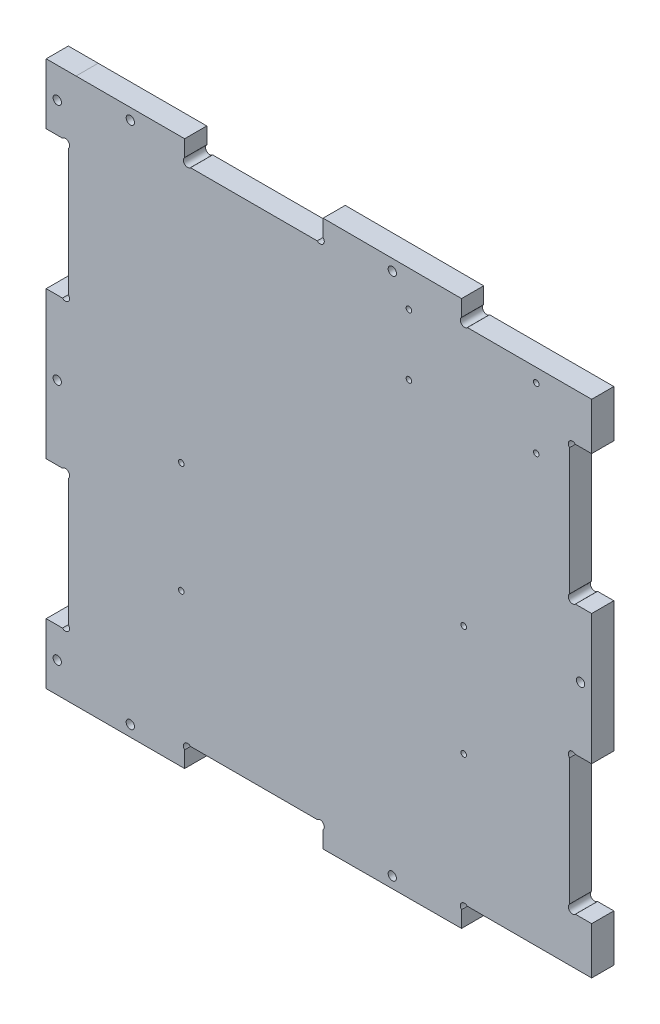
SolidWorks part; units mm, degrees
ref_plane "Plan de face" through (0, 0, 0) normal (0, 0, 1) x (1, 0, 0)
ref_plane "Plan de dessus" through (0, 0, 0) normal (0, 1, 0) x (1, 0, 0)
ref_plane "Plan de droite" through (0, 0, 0) normal (1, 0, 0) x (0, 0, -1)
sketch "Esquisse1" plane through (0, 0, 0) normal (0, 0, 1) x (1, 0, 0)
  line L0 (-32.5678, 3.0393) -> (-40.5679, 24.9325) construction
  line L1 (-40.5679, 24.9325) -> (7.3108, 24.9325) construction
  line L2 (57.3108, 16.9325) -> (11.5535, 16.9325)
  line L3 (9.4321, 24.9325) -> (9.4321, 19.0538)
  line L5 (9.4321, 16.9325) -> (13.1244, 20.6247) construction
  line L6 (156.4321, 16.9325) -> (156.4321, -0.0675)
  line L7 (-34.6892, -46.9607) -> (-40.5679, -46.9607)
  line L8 (59.4321, 25.0903) -> (109.4321, 24.9383)
  line L9 (59.4321, 25.0903) -> (59.4321, 19.0538)
  line L10 (156.4321, -0.0675) -> (150.5535, -0.0675)
  line L11 (156.4321, 16.9325) -> (111.5535, 16.9325)
  line L12 (109.4321, 19.2124) -> (109.4321, 24.9383)
  line L13 (109.4321, 16.9325) -> (113.4674, 20.9678) construction
  line L14 (59.4321, 16.9325) -> (54.8293, 21.5354) construction
  line L15 (-32.5678, 3.0393) -> (-39.0884, -3.4813) construction
  line L16 (-32.5679, -46.9607) -> (-37.4104, -42.1182) construction
  line L17 (156.4321, -73.5675) -> (-71.4834, -73.5675) construction
  line L18 (156.4321, -45.0675) -> (156.4321, -102.0675) construction
  line L19 (-40.5679, -46.9607) -> (-40.5679, -100.1743)
  line L20 (109.4321, 19.0538) -> (109.4321, 19.2124)
  line L21 (148.4321, -2.1888) -> (148.4321, -47.9462)
  line L22 (150.5535, -50.0675) -> (156.4321, -50.0675)
  line L24 (-32.5679, 0.9178) -> (-32.5679, -44.8393)
  line L25 (156.4321, -50.0675) -> (156.4321, -73.5675)
  line L26 (148.4321, -97.0675) -> (166.0552, -114.6905) construction
  line L27 (148.4321, -147.0675) -> (161.2388, -134.2609) construction
  line L28 (-32.5679, -100.1743) -> (-37.4104, -105.0168) construction
  line L29 (-32.5678, -150.1743) -> (-39.0884, -143.6537) construction
  line L30 (-40.5679, 3.0394) -> (-34.6892, 3.0394)
  line L31 (-40.5679, 24.9325) -> (-40.5679, 3.0394)
  line L32 (-29.7962, 24.9325) -> (-40.5679, 24.9325)
  line L33 (59.4321, -164.0675) -> (54.8293, -168.6704) construction
  line L34 (109.4321, -164.0675) -> (113.4674, -168.1028) construction
  line L35 (9.4321, 24.9325) -> (-29.7962, 24.9325)
  line L36 (9.4321, -164.0675) -> (13.1244, -167.7597) construction
  line L37 (-32.5678, -150.1743) -> (-40.5679, -172.0675) construction
  line L38 (9.4321, -172.0675) -> (-29.7962, -172.0675)
  line L39 (-29.7962, -172.0675) -> (-40.5679, -172.0675)
  line L40 (-40.5679, -172.0675) -> (-40.5679, -150.1744)
  line L41 (-40.5679, -150.1744) -> (-34.6892, -150.1744)
  line L42 (-32.5679, -148.0528) -> (-32.5679, -102.2956)
  line L43 (150.5535, -97.0675) -> (156.4321, -97.0675)
  line L44 (148.4321, -0.0675) -> (161.2388, -12.8741) construction
  line L45 (148.4321, -50.0675) -> (166.0552, -32.4444) construction
  line L46 (148.4321, -144.9462) -> (148.4321, -99.1888)
  line L47 (109.4321, -166.1888) -> (109.4321, -166.3474)
  line L48 (148.4321, -50.0675) -> (148.4321, -0.0675) construction
  line L49 (109.4321, 16.9325) -> (156.4321, 16.9325) construction
  line L50 (109.4321, 16.9325) -> (109.4321, 24.9325) construction
  line L51 (109.4321, -166.3474) -> (109.4321, -172.0733)
  line L52 (156.4321, -164.0675) -> (111.5535, -164.0675)
  line L53 (156.4321, -147.0675) -> (150.5535, -147.0675)
  line L54 (59.4321, -172.2253) -> (59.4321, -166.1888)
  line L56 (59.4321, -172.2253) -> (109.4321, -172.0733)
  line L57 (-34.6892, -100.1743) -> (-40.5679, -100.1743)
  line L58 (156.4321, -164.0675) -> (156.4321, -147.0675)
  line L59 (9.4321, -172.0675) -> (9.4321, -166.1888)
  line L60 (57.3108, -164.0675) -> (11.5535, -164.0675)
  line L61 (156.4321, -97.0675) -> (156.4321, -73.5675)
  line L62 (-29.7962, 24.9325) -> (9.4321, 16.9325) construction
  line L63 (-32.5679, -46.9607) -> (-40.5679, -100.1743) construction
  line L64 (-29.7962, -172.0675) -> (9.4321, -164.0675) construction
  line L65 (59.4321, -172.2253) -> (109.4321, -164.0675) construction
  line L66 (148.4321, -50.0675) -> (156.4321, -97.0675) construction
  line L67 (59.4321, 25.0903) -> (109.4321, 16.9325) construction
  circle A0 centre (136.4321, 12.0325) radius 1
  arc A1 (109.4321, 19.0538) -> (111.5535, 16.9325) centre (110.4928, 17.9932) ccw
  arc A2 (9.4321, 19.0538) -> (11.5535, 16.9325) centre (10.4928, 17.9932) ccw
  arc A3 (57.3108, 16.9325) -> (59.4321, 19.0538) centre (58.3715, 17.9932) ccw
  arc A4 (-32.5679, 0.9178) -> (-34.6892, 3.0394) centre (-33.6285, 1.9786) ccw
  arc A5 (-34.6892, -46.9607) -> (-32.5679, -44.8393) centre (-33.6285, -45.9) ccw
  circle A6 centre (8.2321, -77.0675) radius 1
  arc A7 (150.5535, -0.0675) -> (148.4321, -2.1888) centre (149.4928, -1.1281) ccw
  circle A8 centre (8.2321, -117.0675) radius 1
  circle A9 centre (110.2321, -117.0675) radius 1
  arc A11 (148.4321, -99.1888) -> (150.5535, -97.0675) centre (149.4928, -98.1281) cw
  arc A12 (148.4321, -47.9462) -> (150.5535, -50.0675) centre (149.4928, -49.0068) ccw
  arc A13 (150.5535, -147.0675) -> (148.4321, -144.9462) centre (149.4928, -146.0068) cw
  arc A14 (-34.6892, -100.1743) -> (-32.5679, -102.2956) centre (-33.6285, -101.235) cw
  arc A15 (-32.5679, -148.0528) -> (-34.6892, -150.1744) centre (-33.6285, -149.1136) cw
  arc A16 (57.3108, -164.0675) -> (59.4321, -166.1888) centre (58.3715, -165.1281) cw
  arc A17 (9.4321, -166.1888) -> (11.5535, -164.0675) centre (10.4928, -165.1281) cw
  arc A18 (109.4321, -166.1888) -> (111.5535, -164.0675) centre (110.4928, -165.1281) cw
  circle A20 centre (84.4321, 21.0114) radius 1.5
  circle A21 centre (90.4321, 12.0325) radius 1
  circle A22 centre (90.4321, -9.9675) radius 1
  circle A23 centre (136.4321, -9.9675) radius 1
  circle A24 centre (-10.182, 20.9325) radius 1.5
  circle A25 centre (-36.5678, 13.9859) radius 1.5
  circle A26 centre (-36.5679, -73.5675) radius 1.5
  circle A27 centre (-36.5678, -161.1209) radius 1.5
  circle A28 centre (110.2321, -77.0675) radius 1
  circle A29 centre (-10.182, -168.0675) radius 1.5
  circle A30 centre (84.4321, -168.1464) radius 1.5
  circle A31 centre (152.4321, -73.5675) radius 1.5
  point P119 (-40.5679, -70.4606)
  point P140 (-40.5679, -76.6743)
  point P141 (-38.6455, 3.0394)
  point P142 (-38.6455, 3.0394)
  point P143 (-38.6455, 3.0394)
  point P144 (-38.6455, 3.0394)
  dimension "D1" = 45
  dimension "D2" = 45
  dimension "D5" = 45
  dimension "D8" = 0
  dimension "D12" = 46
  dimension "D13" = 22
  dimension "D6" = 45
  dimension "D10" = 45
  dimension "D4" = 4.9
  dimension "D3" = 0
  dimension "D7" = 0
  dimension "D9" = 0
  dimension "D11" = 45
  dimension "D14" = 22
extrude "Boss.-Extru.1" add sketch "Esquisse1" along normal blind 8
